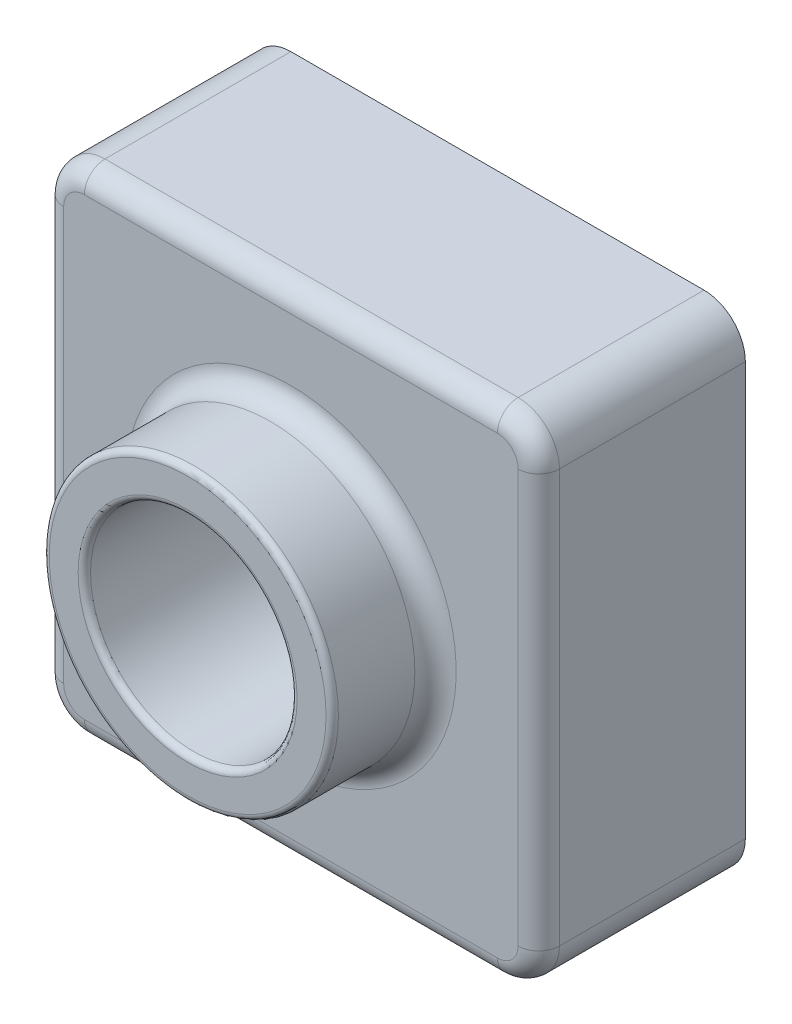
SolidWorks part; units mm, degrees
ref_plane "Front" through (0, 0, 0) normal (0, 0, 1) x (1, 0, 0)
ref_plane "Top" through (0, 0, 0) normal (0, 1, 0) x (1, 0, 0)
ref_plane "Right" through (0, 0, 0) normal (1, 0, 0) x (0, 0, -1)
sketch "Sketch1" plane through (0, 0, 0) normal (0, 0, 1) x (1, 0, 0)
  line L1 (0, 0) -> (120, 0)
  line L2 (0, 0) -> (0, 120)
  line L3 (0, 120) -> (120, 120)
  line L4 (120, 0) -> (120, 120)
  dimension "D1" = 120
  dimension "D2" = 120
extrude "Boss-Extrude1" add sketch "Sketch1" along normal blind 50
sketch "Sketch2" plane through (0, 0, 50) normal (0, 0, 1) x (1, 0, 0)
  line L0 (120, 120) -> (0, 120) construction
  line L1 (0, 120) -> (0, 0) construction
  circle A0 centre (60, 60) radius 35
  dimension "D1" = 70
  dimension "D2" = 60
  dimension "D3" = 60
extrude "Boss-Extrude2" add sketch "Sketch2" along normal blind 25
sketch "Sketch3" plane through (0, 0, 75) normal (0, 0, 1) x (1, 0, 0)
  circle A0 centre (60, 60) radius 25
  dimension "D1" = 50
extrude "Cut-Extrude1" cut sketch "Sketch3" against normal through all
fillet "Fillet1" radius 10 4 edges at (0, 0, 25) (120, 0, 25) (120, 120, 25) (0, 120, 25)
fillet "Fillet2" radius 1.5 2 edges at (95, 60, 75) (85, 60, 75)
fillet "Fillet3" radius 5 9 edges at (25, 60, 50) (2.9289, 117.0711, 50) (60, 120, 50) (117.0711, 117.0711, 50) (120, 60, 50) (117.0711, 2.9289, 50) (60, 0, 50) (2.9289, 2.9289, 50) (0, 60, 50)
shell "Shell1" thickness 2
